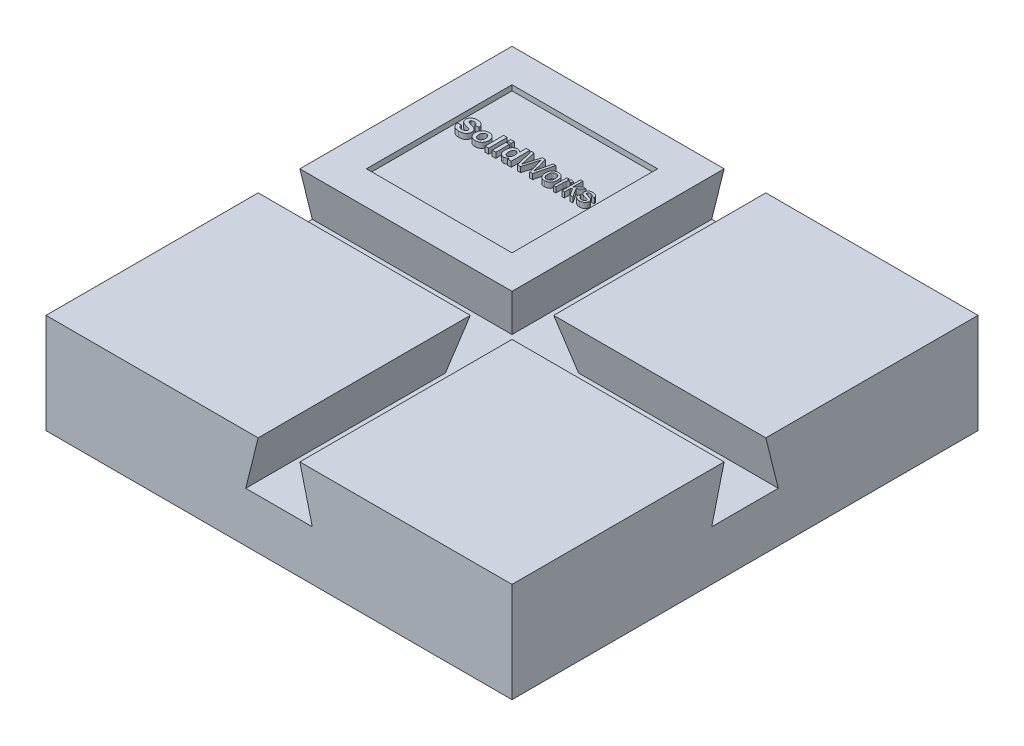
SolidWorks part; units mm, degrees
ref_plane "Front" through (0, 0, 0) normal (0, 0, 1) x (1, 0, 0)
ref_plane "Top" through (0, 0, 0) normal (0, 1, 0) x (1, 0, 0)
ref_plane "Right" through (0, 0, 0) normal (1, 0, 0) x (0, 0, -1)
sketch "Sketch1" plane through (0, 0, 0) normal (0, 1, 0) x (1, 0, 0)
  line L0 (-44.45, -44.45) -> (44.45, -44.45)
  line L1 (-44.45, -44.45) -> (-44.45, 44.45)
  line L2 (44.45, 44.45) -> (-44.45, 44.45)
  line L3 (44.45, 44.45) -> (44.45, -44.45)
  line L4 (-44.45, -44.45) -> (44.45, 44.45) construction
  dimension "D1" = 88.9
extrude "Base-Extrude" add sketch "Sketch1" along normal blind 19.05
sketch "Sketch2" plane through (0, 0, 44.45) normal (0, 0, 1) x (1, 0, 0)
  line L0 (0, -6.2714) -> (0, 26.7115) construction
  line L1 (6.35, 9.525) -> (-6.35, 9.525)
  line L2 (-6.35, 9.525) -> (-3.9752, 19.05)
  line L3 (-44.45, 19.05) -> (44.45, 19.05) construction
  line L4 (6.35, 9.525) -> (3.9752, 19.05)
  line L5 (-3.9752, 19.05) -> (3.9752, 19.05)
  point P6 (0, 9.525)
  point P11 (0, 19.05)
  dimension "D1" = 28
  dimension "D2" = 9.525
  dimension "D3" = 12.7
extrude "Cut-Extrude1" cut sketch "Sketch2" against normal through all
sketch "Sketch3" plane through (44.45, -3.5382, -0.6646) normal (1, 0, 0) x (0, 0, -1)
  line L0 (-0.6646, -6.2714) -> (-0.6646, 26.7115) construction
  line L1 (5.6854, 13.0632) -> (-7.0146, 13.0632)
  line L2 (-7.0146, 13.0632) -> (-4.6397, 22.5882)
  line L3 (43.7854, 22.5882) -> (-45.1146, 22.5882) construction
  line L4 (5.6854, 13.0632) -> (3.3106, 22.5882)
  line L5 (-4.6397, 22.5882) -> (3.3106, 22.5882)
  point P6 (-0.6646, 13.0632)
  point P11 (-0.6646, 22.5882)
  dimension "D1" = 28
  dimension "D2" = 9.525
  dimension "D3" = 12.7
extrude "Cut-Extrude2" cut sketch "Sketch3" against normal through all
sketch "Sketch4" plane through (0, 19.05, 0) normal (0, 1, 0) x (-1, 0, 0)
  line L4 (38.1, -10.3252) -> (38.1, -38.1)
  line L5 (38.1, -10.3252) -> (10.3252, -10.3252)
  line L6 (10.3252, -38.1) -> (10.3252, -10.3252)
  line L7 (10.3252, -38.1) -> (38.1, -38.1)
  line L8 (38.1, -10.3252) -> (38.1, -38.1)
  line L9 (38.1, -10.3252) -> (10.3252, -10.3252)
  line L10 (10.3252, -38.1) -> (10.3252, -10.3252)
  line L11 (10.3252, -38.1) -> (38.1, -38.1)
  dimension "D1" = 6.35
extrude "Cut-Extrude3" cut sketch "Sketch4" against normal blind 1.016
sketch "Sketch5" plane through (20.6937, 18.034, -39.2257) normal (0, 1, 0) x (1, 0, 0)
  line L0 (-31.0189, -1.1257) -> (-58.7937, -1.1257) construction
  line L1 (-58.7937, -1.1257) -> (-58.7937, -28.9005) construction
  text T0 "Solid" font "Arial" height in points 14
  point P1 (0, 0)
  dimension "D1" = 12.7
  dimension "D2" = 0.951
extrude "Boss-Extrude1" add sketch "Sketch5" along normal blind 1.016
sketch "Sketch6" plane through (42.6288, 18.034, -41.3404) normal (0, 1, 0) x (1, 0, 0)
  line L0 (-68.175, -12.4051) -> (-68.175, -15.9404) construction
  text T0 "Works" font "Arial" height in points 14
  dimension "D1" = 0.254
extrude "Boss-Extrude2" add sketch "Sketch6" along normal blind 1.016
other "LibFeat1"
